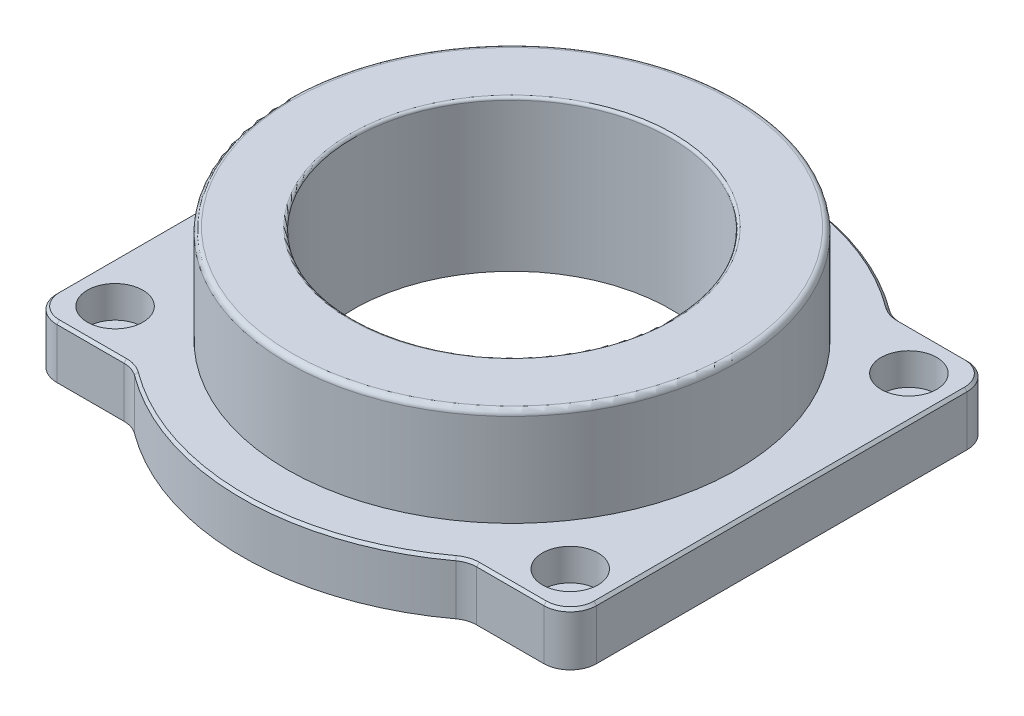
SolidWorks part; units mm, degrees
ref_plane "Front Plane" through (0, 0, 0) normal (0, 0, 1) x (1, 0, 0)
ref_plane "Top Plane" through (0, 0, 0) normal (0, 1, 0) x (1, 0, 0)
ref_plane "Right Plane" through (0, 0, 0) normal (1, 0, 0) x (0, 0, -1)
sketch "Sketch1" plane through (0, 0, 0) normal (0, 1, 0) x (1, 0, 0)
  line L0 (-1000, 0) -> (49000, 0) construction
  line L1 (-46, 40) -> (-33.3317, 40)
  line L2 (-51, 35) -> (-51, -35)
  line L3 (-46, -40) -> (-33.3317, -40)
  line L4 (51, 35) -> (51, -35)
  line L5 (33.3317, -40) -> (46, -40)
  line L6 (33.3317, 40) -> (46, 40)
  arc A0 (-30.3556, -40.9821) -> (30.3556, -40.9821) centre (0, 0) ccw
  arc A1 (30.3556, 40.9821) -> (-30.3556, 40.9821) centre (0, 0) ccw
  arc A2 (-51, -35) -> (-46, -40) centre (-46, -35) ccw
  arc A3 (46, -40) -> (51, -35) centre (46, -35) ccw
  arc A4 (46, 40) -> (51, 35) centre (46, 35) cw
  arc A5 (-46, 40) -> (-51, 35) centre (-46, 35) ccw
  arc A6 (-30.3556, -40.9821) -> (-33.3317, -40) centre (-33.3317, -45) ccw
  arc A7 (30.3556, -40.9821) -> (33.3317, -40) centre (33.3317, -45) cw
  arc A8 (30.3556, 40.9821) -> (33.3317, 40) centre (33.3317, 45) ccw
  arc A9 (-33.3317, 40) -> (-30.3556, 40.9821) centre (-33.3317, 45) ccw
  point P24 (31.6386, -40)
  point P27 (31.6386, 40)
  dimension "D1" = 102
  dimension "D4" = 5
  dimension "D5" = 5
  dimension "D2" = 80
  dimension "D3" = 102
extrude "Boss-Extrude1" add sketch "Sketch1" along normal blind 10
sketch "Sketch2" plane through (0, 10, 0) normal (0, 1, 0) x (1, 0, 0)
  circle A0 centre (0, 0) radius 42.5
  dimension "D1" = 85
extrude "Boss-Extrude2" add sketch "Sketch2" along normal blind 18.5
sketch "Sketch3" plane through (0, 28.5, 0) normal (0, 1, 0) x (1, 0, 0)
  circle A0 centre (0, 0) radius 30
  dimension "D1" = 60
extrude "Cut-Extrude1" cut sketch "Sketch3" against normal through all
hole_wizard "CBORE for M6 SHCS1" positions "Sketch5" profile "Sketch4" counterbore size "M6" standard "ANSI Metric"
sketch "Sketch5" plane through (0, 10, 0) normal (0, 1, 0) x (1, 0, 0)
  line L0 (0, -1000) -> (0, 49000) construction
  line L1 (-1000, 0) -> (49000, 0) construction
  line L2 (-51, 35) -> (-51, -35) construction
  line L3 (-33.3317, 40) -> (-46, 40) construction
  point P0 (-43, -32)
  point P2 (43, -32)
  point P4 (43, 32)
  point P6 (-43, 32)
  dimension "D1" = 8
  dimension "D2" = 8
sketch "Sketch4" plane through (-43, 10, 32) normal (1, 0, 0) x (0, 0, 1)
  line L0 (0, 0) -> (0, 10)
  line L1 (0, 10) -> (3.2, 10)
  line L3 (3.2, 10) -> (3.2, 6)
  line L4 (3.2, 6) -> (5.25, 6)
  line L5 (5.25, 6) -> (5.25, 0)
  line L7 (5.25, 0) -> (0, 0)
  line L11 (0, -6.35) -> (0, 107.95) construction
  dimension "Thru Hole Dia." = 6.4
  dimension "Thru Hole Depth" = 10
  dimension "C'Bore Dia." = 10.5
  dimension "C'Bore Depth" = 6
chamfer "Chamfer1" distance 0.5 angle 45 16 edges at (0, 10, 51) (31.7647, 10, 40.2519) (-31.7647, 10, 40.2519) (39.6658, 10, 40) (-39.6658, 10, 40) (49.5355, 10, 38.5355) (-49.5355, 10, 38.5355) (51, 10, 0) (-51, 10, 0) (49.5355, 10, -38.5355) (-49.5355, 10, -38.5355) (39.6658, 10, -40) (-39.6658, 10, -40) (31.7647, 10, -40.2519) (-31.7647, 10, -40.2519) (0, 10, -51)
fillet "Fillet1" radius 1 1 edges at (0, 28.5, 42.5)
fillet "Fillet2" radius 0.5 1 edges at (0, 28.5, 30)
